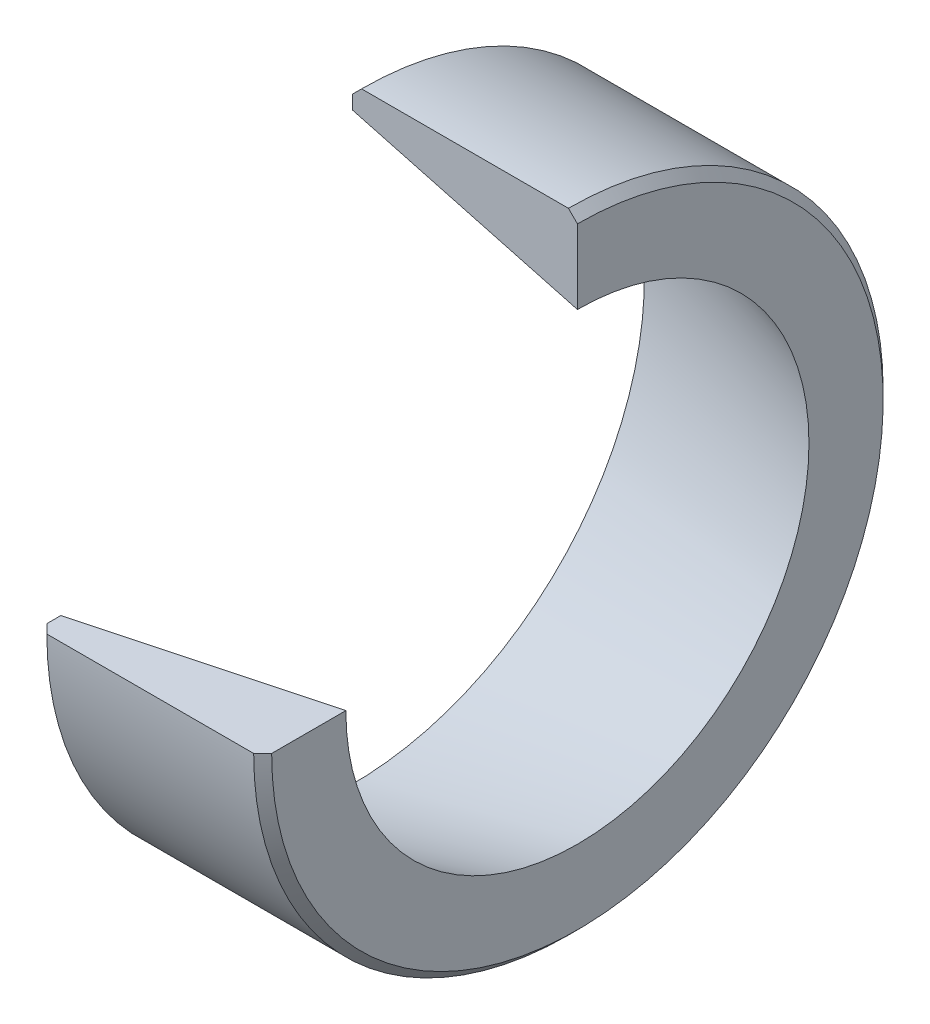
SolidWorks part; units mm, degrees
ref_plane "Face" through (0, 0, 0) normal (0, 0, 1) x (1, 0, 0)
ref_plane "Dessus" through (0, 0, 0) normal (0, 1, 0) x (1, 0, 0)
ref_plane "Droite" through (0, 0, 0) normal (1, 0, 0) x (0, 0, -1)
sketch "Esquisse1" plane through (0, 0, 0) normal (0, 0, 1) x (1, 0, 0)
  line L0 (-7.0437, 0) -> (21.7271, 0) construction
  line L1 (0, 7) -> (0, 6.4897)
  line L2 (0, 6.4897) -> (5, 5.15)
  line L3 (5, 5.15) -> (5, 7)
  line L4 (0, 7) -> (5, 7)
  dimension "D1" = 10.3
  dimension "D2" = 14
  dimension "D3" = 15
  dimension "D5" = 5
revolve "Base-Révolution" add sketch "Esquisse1" angle 360 about L0
sketch "Esquisse2" plane through (5, 0, 0) normal (1, 0, 0) x (0, 0, -1)
  line L0 (0, 0) -> (0, 7)
  line L1 (0, 0) -> (-7, 0)
  circle A0 centre (0, 0) radius 7 construction
  arc A1 (0, 7) -> (-7, 0) centre (0, 0) ccw
extrude "COUPE" cut sketch "Esquisse2" against normal up to next
chamfer "Chanfrein1" distance 0.2 angle 45 2 edges at (5, -4.9497, -4.9497) (0, -4.9497, -4.9497)
